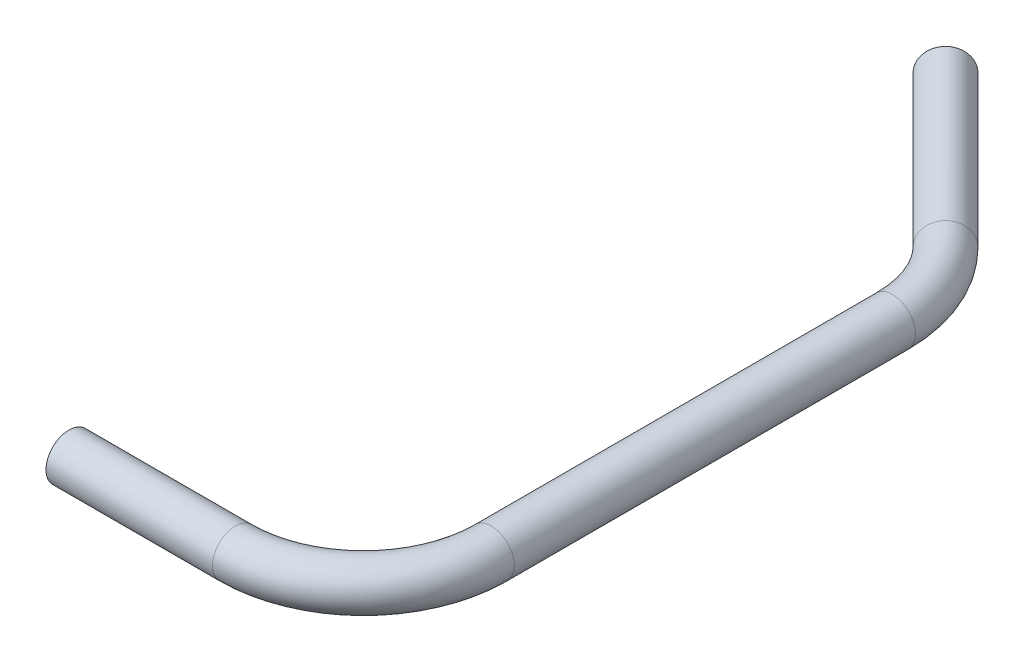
SolidWorks part; units mm, degrees
ref_plane "Plan de face" through (0, 0, 0) normal (0, 0, 1) x (1, 0, 0)
ref_plane "Plan de dessus" through (0, 0, 0) normal (0, 1, 0) x (1, 0, 0)
ref_plane "Plan de droite" through (0, 0, 0) normal (1, 0, 0) x (0, 0, -1)
imported_body "Importée3"
sketch "Esquisse1" plane through (97.5, 0, 0) normal (-1, 0, 0) x (0, 0, 1)
  circle A0 centre (0, 0) radius 13.45
extrude "Boss.-Extru.1" add sketch "Esquisse1" along normal blind 97.5
ref_plane "Plan1" through (0, 0, 0) normal (0, 0, -1) x (-1, 0, 0)
sketch "Esquisse2" plane through (0, 0, 0) normal (0, 0, -1) x (-1, 0, 0)
  line L0 (-97.5, 11.15) -> (-97.5, 0)
  line L1 (-97.5, 0) -> (0, 0)
  line L2 (0, 0) -> (0, 11.15)
  line L3 (0, 11.15) -> (-97.5, 11.15)
  line L4 (-97.5, 0) -> (0, 0) construction
revolve "Enlèvement de matière-Révolution1" cut sketch "Esquisse2" angle 360 about L4
sketch "Esquisse3" plane through (0, 0, 0) normal (0, 1, 0) x (1, 0, 0)
  line L0 (183.65, 310) -> (172.5, 310)
  line L1 (172.5, 310) -> (172.5, 75)
  line L2 (172.5, 75) -> (183.65, 75)
  line L3 (183.65, 75) -> (183.65, 310)
  line L4 (172.5, 310) -> (172.5, 75) construction
revolve "Enlèvement de matière-Révolution2" cut sketch "Esquisse3" angle 360 about L4
sketch "Esquisse4" plane through (-194.6383, 0, -194.6383) normal (-0.7071, 0, -0.7071) x (-0.7071, 0, 0.7071)
  point P0 (-363.146, 0)
